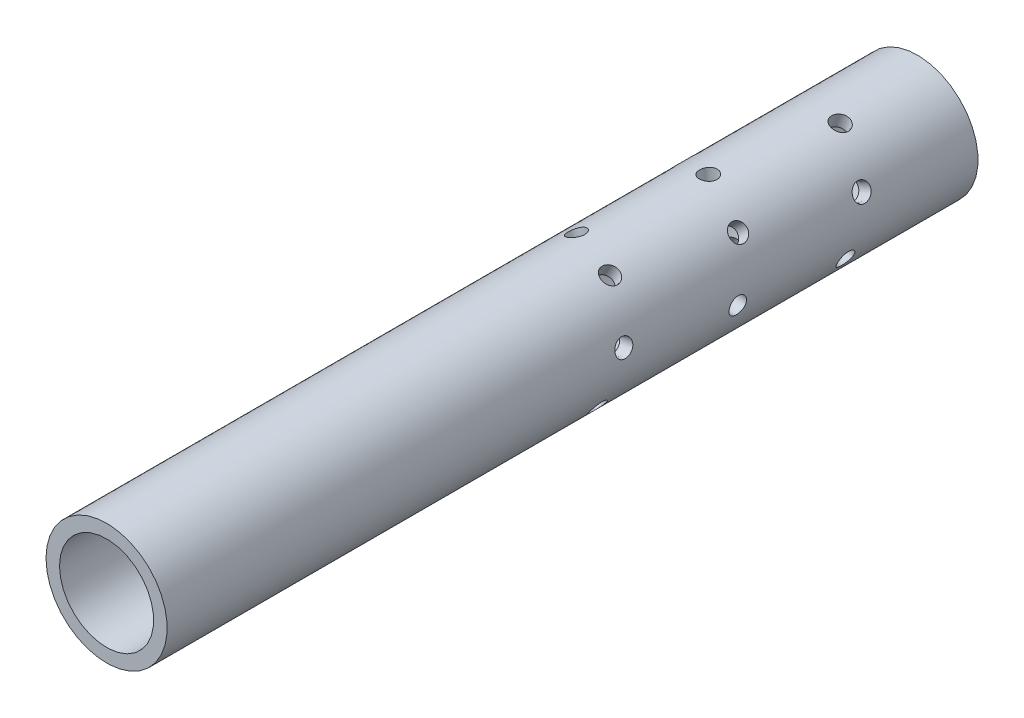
SolidWorks part; units mm, degrees
ref_plane "Ebene vorne" through (0, 0, 0) normal (0, 0, 1) x (1, 0, 0)
ref_plane "Ebene oben" through (0, 0, 0) normal (0, 1, 0) x (1, 0, 0)
ref_plane "Ebene rechts" through (0, 0, 0) normal (1, 0, 0) x (0, 0, -1)
sketch "Skizze1" plane through (0, 0, 0) normal (0, 0, 1) x (1, 0, 0)
  circle A0 centre (0, 0) radius 17.4125
extrude "Linear-Austragen-Dünn1" add sketch "Skizze1" along normal blind 300 thin
sketch "Skizze2" plane through (0, 0, 0) normal (0, 0, 1) x (1, 0, 0)
  circle A0 centre (0, 0) radius 22.4125 construction
  circle A1 centre (0, 0) radius 22.4125
curve "Spirale/Helix1"
sketch3d "3D-Skizze2"
  spline S1 degree 3 number of poles 83 (22.4125, 0, 0) -> (0, 22.4125, 165)
  spline S2 degree 3 number of poles 83 (22.4125, 0, 0) -> (0, 22.4125, 165)
  dimension "D1" = 0
hole_wizard "Ø6.5 (6.5) Durchmesser Bohrung1" positions "3D-Skizze3" profile "Skizze5" hole size "Ø6.5" standard "DIN"
sketch3d "3D-Skizze3"
  spline S0 degree 3 number of poles 83 (22.4125, 0, 0) -> (0, 22.4125, 165) construction
  point P0 (6.506, 21.4474, 35.0625)
sketch "Skizze5" plane through (6.506, 21.4474, 35.0625) normal (0, 0, 1) x (-0.9569, 0.2903, 0)
  line L0 (0, 0) -> (0, 5)
  line L1 (0, 5) -> (3.25, 5)
  line L2 (3.25, 5) -> (3.25, 0)
  line L5 (3.25, 0) -> (0, 0)
  line L11 (0, -6.35) -> (0, 107.95) construction
  dimension "Bohrerdurchmesser" = 6.5
  dimension "Bohrungstiefe" = 5
pattern_curve "Kurvenmuster1" of "Ø6.5 (6.5) Durchmesser Bohrung1" parameters "D1"=21, "D3"=20, "D2"=1, "D4"=5
equation "\"LÄNGE\"=0"
equation "\"BREITE\"=0"
equation "\"HÖHE\"=0"
equation "\"DURCHMESSER\"=0"
equation "\"Stückzahl\"= 1"
